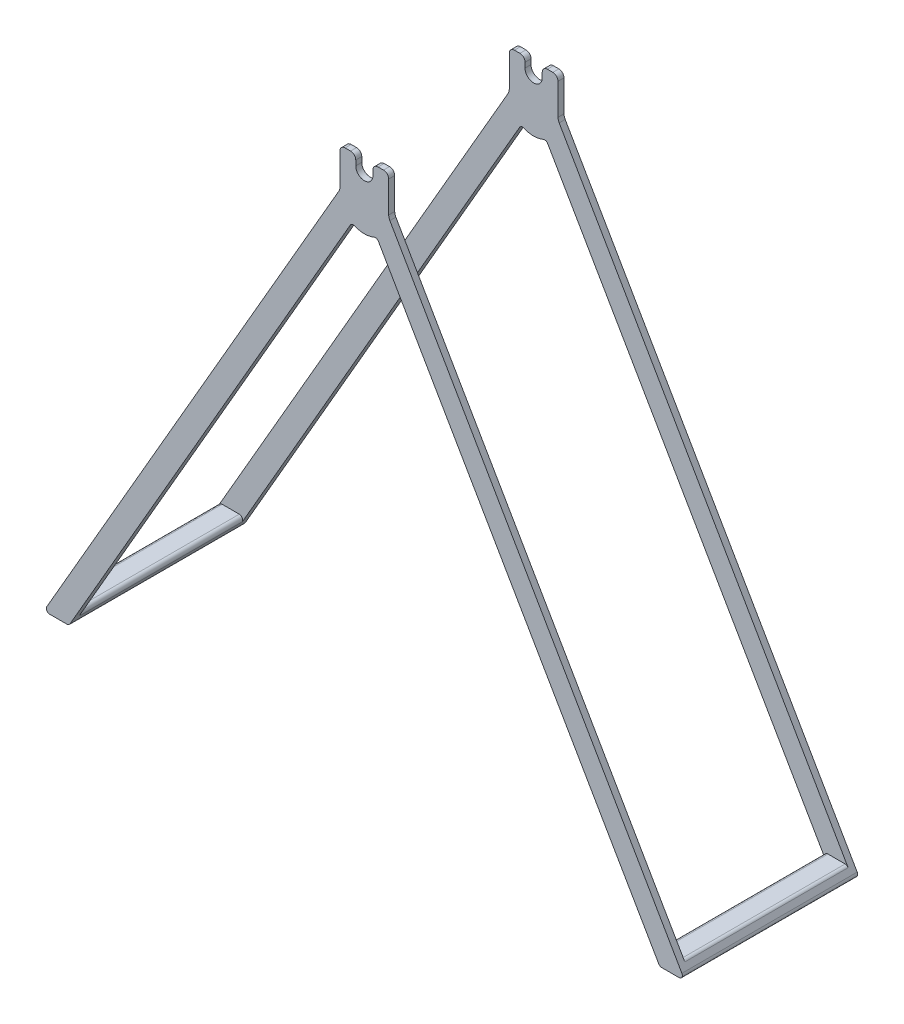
SolidWorks part; units mm, degrees
ref_plane "Piano frontale" through (0, 0, 0) normal (0, 0, 1) x (1, 0, 0)
ref_plane "Piano superiore" through (0, 0, 0) normal (0, 1, 0) x (1, 0, 0)
ref_plane "Piano destro" through (0, 0, 0) normal (1, 0, 0) x (0, 0, -1)
sketch "Schizzo1" plane through (0, 0, 0) normal (0, 0, 1) x (1, 0, 0)
  line L3 (-183.0387, -191.6857) -> (-173.0387, -191.6857)
  line L4 (-14.8469, 105.631) -> (-184.7707, -188.6857)
  line L5 (0, 0) -> (0, 183.8705) construction
  line L6 (-171.3066, -190.6857) -> (-8.177, 91.8631)
  line L17 (-14.177, 108.131) -> (-14.177, 126.2595)
  line L18 (-11.177, 129.2595) -> (-8, 129.2595)
  line L19 (-5, 126.2595) -> (-5, 123.3143)
  line L20 (5, 126.2595) -> (5, 123.3143)
  line L21 (11.177, 129.2595) -> (8, 129.2595)
  line L22 (14.177, 108.131) -> (14.177, 126.2595)
  line L23 (14.8469, 105.631) -> (184.7707, -188.6857)
  line L24 (183.0387, -191.6857) -> (173.0387, -191.6857)
  line L25 (171.3066, -190.6857) -> (8.177, 91.8631)
  arc A10 (-173.0387, -191.6857) -> (-171.3066, -190.6857) centre (-173.0387, -189.6857) ccw
  arc A11 (-184.7707, -188.6857) -> (-183.0387, -191.6857) centre (-183.0387, -189.6857) ccw
  arc A14 (-5, 123.3143) -> (5, 123.3143) centre (0, 123.3143) ccw
  arc A15 (-5.6626, 92.7037) -> (5.6626, 92.7037) centre (0, 106.0261) ccw
  arc A16 (-8.177, 91.8631) -> (-5.6626, 92.7037) centre (-6.4449, 90.8631) cw
  arc A17 (-14.8469, 105.631) -> (-14.177, 108.131) centre (-19.177, 108.131) ccw
  arc A18 (-8, 129.2595) -> (-5, 126.2595) centre (-8, 126.2595) cw
  arc A19 (-14.177, 126.2595) -> (-11.177, 129.2595) centre (-11.177, 126.2595) cw
  arc A20 (14.8469, 105.631) -> (14.177, 108.131) centre (19.177, 108.131) cw
  arc A21 (8.177, 91.8631) -> (5.6626, 92.7037) centre (6.4449, 90.8631) ccw
  arc A22 (8, 129.2595) -> (5, 126.2595) centre (8, 126.2595) ccw
  arc A23 (14.177, 126.2595) -> (11.177, 129.2595) centre (11.177, 126.2595) ccw
  arc A24 (184.7707, -188.6857) -> (183.0387, -191.6857) centre (183.0387, -189.6857) cw
  arc A25 (173.0387, -191.6857) -> (171.3066, -190.6857) centre (173.0387, -189.6857) cw
  point P11 (0, 0)
  point P13 (-13.9454, 103.3525)
  point P16 (-7.1524, 95.4273)
  point P36 (-171.884, -191.6857)
  point P39 (-186.5028, -191.6857)
  point P48 (0, 118.3143)
  dimension "D4" = 310
  dimension "D5" = 2
  dimension "D6" = 5
  dimension "D7" = 3
  dimension "D2" = 2
  dimension "D1" = 5
  dimension "D3" = 30
  dimension "D9" = 10
extrude "Estrusione-Estrusione1" add sketch "Schizzo1" along normal blind 3.5 contours L6 A16 A15 A21 L25 A25 L24 A24 L23 A20 L22 A23 L21 A22 L20 A14 L19 A18 L18 A19 L17 A17 L4 A11 L3 A10
ref_plane "Piano1" through (0, 0, 51) normal (0, 0, 1) x (1, 0, 0)
mirror "Specchia2" about plane through (0, 0, 51) normal (0, 0, 1)
sketch "Schizzo3" plane through (0, 0, 3.5) normal (0, 0, 1) x (1, 0, 0)
  line L0 (14.8469, 105.631) -> (184.7707, -188.6857) construction
  line L1 (171.3066, -190.6857) -> (8.177, 91.8631) construction
  line L2 (183.0387, -191.6857) -> (173.0387, -191.6857) construction
  line L3 (182.9889, -185.5995) -> (184.7707, -188.6857)
  line L4 (171.3066, -190.6857) -> (169.5248, -187.5995)
  line L5 (183.0387, -191.6857) -> (173.0387, -191.6857)
  line L6 (171.2569, -184.5995) -> (181.2569, -184.5995)
  arc A0 (183.0387, -191.6857) -> (184.7707, -188.6857) centre (183.0387, -189.6857) ccw construction
  arc A1 (171.3066, -190.6857) -> (173.0387, -191.6857) centre (173.0387, -189.6857) ccw construction
  arc A2 (183.0387, -191.6857) -> (184.7707, -188.6857) centre (183.0387, -189.6857) ccw
  arc A3 (171.3066, -190.6857) -> (173.0387, -191.6857) centre (173.0387, -189.6857) ccw
  arc A4 (181.2569, -184.5995) -> (182.9889, -185.5995) centre (181.2569, -186.5995) cw
  arc A5 (171.2569, -184.5995) -> (169.5248, -187.5995) centre (171.2569, -186.5995) ccw
  dimension "D1" = 2
ref_plane "Piano2" through (0, 0, 0) normal (-1, 0, 0) x (0, 0, 1)
extrude "Estrusione-Estrusione2" add sketch "Schizzo3" along normal up to next (98.5 mm away)
mirror "Specchia3" about plane through (0, 0, 0) normal (-1, 0, 0) of "Estrusione-Estrusione2"
